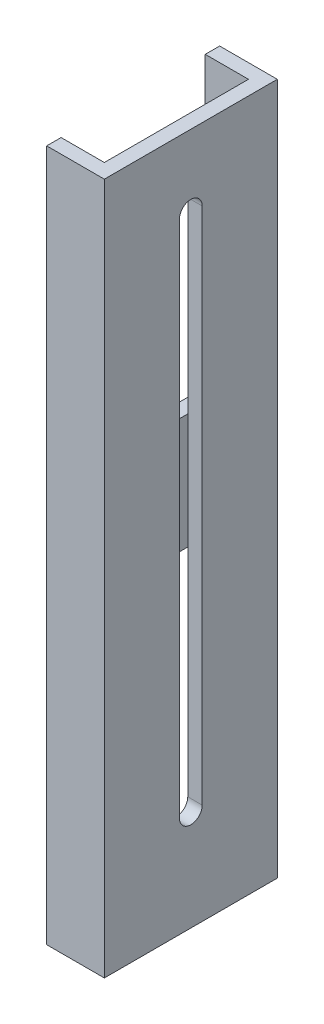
SolidWorks part; units mm, degrees
ref_plane "Front Plane" through (0, 0, 0) normal (1, 0, 0) x (0, 1, 0)
ref_plane "Top Plane" through (0, 0, 0) normal (0, 0, 1) x (0, 1, 0)
ref_plane "Right Plane" through (0, 0, 0) normal (0, 1, 0) x (-1, 0, 0)
sketch "Sketch1" plane through (0, 0, 0) normal (0, 1, 0) x (-1, 0, 0)
  line L0 (0, -19.05) -> (0, 19.05)
  line L1 (0, 19.05) -> (12.7, 19.05)
  line L2 (12.7, 19.05) -> (12.7, 15.875)
  line L3 (12.7, 15.875) -> (3.175, 15.875)
  line L4 (3.175, 15.875) -> (3.175, -15.875)
  line L5 (6.985, 0) -> (-6.985, 0) construction
  line L6 (12.7, -15.875) -> (3.175, -15.875)
  line L7 (12.7, -19.05) -> (12.7, -15.875)
  line L8 (0, -19.05) -> (12.7, -19.05)
  point P10 (3.175, 0)
  point P13 (0, 0)
  dimension "D1" = 3.175
  dimension "D2" = 3.175
  dimension "D3" = 12.7
  dimension "D4" = 19.05
extrude "Boss-Extrude1" add sketch "Sketch1" along normal mid plane 152.4
sketch "Sketch2" plane through (-3.175, 0, 0) normal (-1, 0, 0) x (0, -1, 0)
  line L0 (-60.309, 0) -> (53.991, 0) construction
  line L1 (-60.309, 2.5) -> (53.991, 2.5)
  line L2 (-60.309, -2.5) -> (53.991, -2.5)
  arc A0 (-60.309, 2.5) -> (-60.309, -2.5) centre (-60.309, 0) ccw
  arc A1 (53.991, -2.5) -> (53.991, 2.5) centre (53.991, 0) ccw
  point P3 (-3.159, 0)
  dimension "D1" = 2.5
  dimension "D2" = 114.3
extrude "Cut-Extrude1" cut sketch "Sketch2" against normal blind 152.4
sketch "Sketch3" plane through (0, 0, 15.875) normal (0, 0, -1) x (1, 0, 0)
  line L0 (-12.7, -76.2) -> (-12.7, 76.2) construction
  line L1 (-9.525, -12.7) -> (-12.7, -12.7)
  line L2 (-9.525, -12.7) -> (-9.525, 12.7)
  line L3 (-9.525, 12.7) -> (-12.7, 12.7)
  line L4 (-12.7, -12.7) -> (-12.7, 12.7)
  line L5 (-9.525, -12.7) -> (-12.7, 12.7) construction
  line L6 (-9.525, 12.7) -> (-12.7, -12.7) construction
  point P0 (-11.1125, 0)
  dimension "D1" = 3.175
  dimension "D2" = 25.4
extrude "Boss-Extrude2" add sketch "Sketch3" along normal through all
